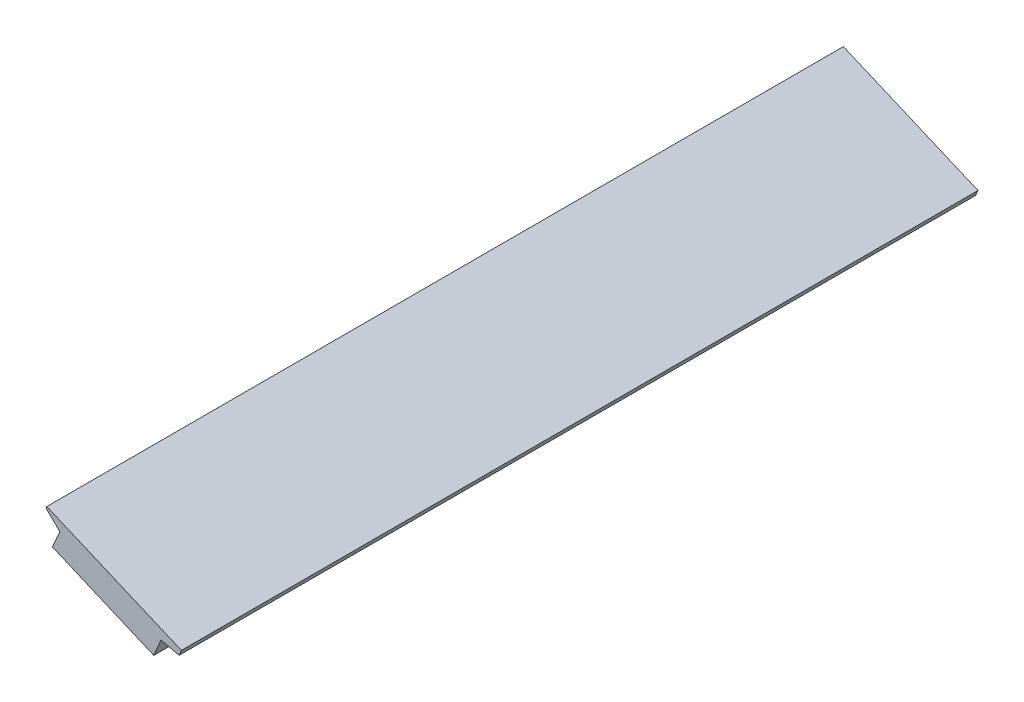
SolidWorks part; units mm, degrees
ref_plane "Front" through (0, 0, 0) normal (0, 0, 1) x (1, 0, 0)
ref_plane "Top" through (0, 0, 0) normal (0, 1, 0) x (1, 0, 0)
ref_plane "Right" through (0, 0, 0) normal (1, 0, 0) x (0, 0, -1)
sketch "Sketch1" plane through (0, 0, 0) normal (0, 0, 1) x (1, 0, 0)
  line L0 (-20.7867, -19.2196) -> (-31.8697, -14.5027)
  line L1 (-31.8697, -14.5027) -> (-31.0381, -12.6645)
  line L2 (-31.0381, -12.6645) -> (-32.5604, -11.1769)
  line L3 (-32.5604, -11.1769) -> (-32.4737, -10.9853)
  line L4 (-32.4737, -10.9853) -> (-17.7713, -17.2426)
  line L5 (-17.7713, -17.2426) -> (-18.0217, -17.8309)
  line L6 (-18.0217, -17.8309) -> (-20, -17.3719)
  line L7 (-20, -17.3719) -> (-20.7867, -19.2196)
  dimension "D1" = 110
  dimension "D2" = 100
  dimension "D3" = 2
  dimension "D4" = 2
  dimension "D5" = 3
extrude "Extrude1" add sketch "Sketch1" along normal mid plane 87
